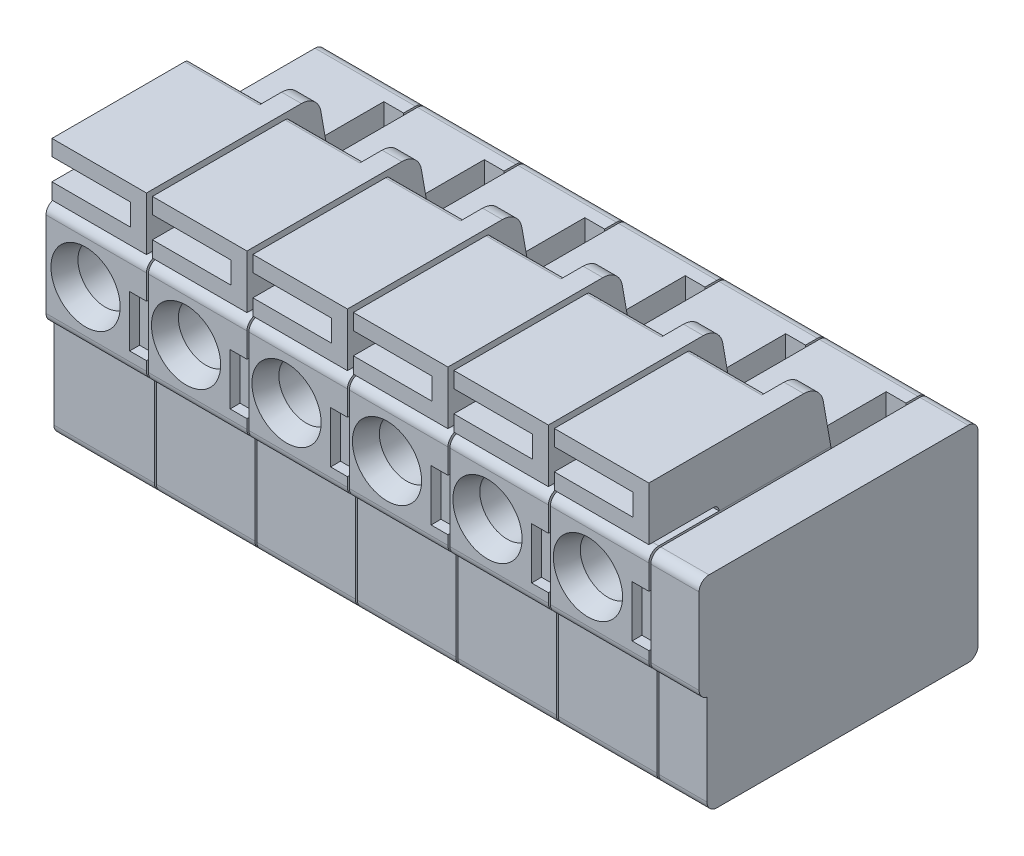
SolidWorks part; units mm, degrees
ref_plane "Спереди" through (0, 0, 0) normal (0, 0, 1) x (1, 0, 0)
ref_plane "Сверху" through (0, 0, 0) normal (0, 1, 0) x (1, 0, 0)
ref_plane "Справа" through (0, 0, 0) normal (1, 0, 0) x (0, 0, -1)
sketch "Эскиз1" plane through (0, 0, 0) normal (1, 0, 0) x (0, 0, -1)
  line L0 (54.1667, 191) -> (270.8333, 191) construction
  line L1 (0, 0) -> (14.1, 0)
  line L2 (0, 0) -> (0, 13.4)
  line L3 (0, 13.4) -> (14.1, 13.4)
  line L4 (14.1, 0) -> (14.1, 13.4)
  line L5 (0, 10.4) -> (14.1, 10.4)
  line L7 (0.4, 5.1) -> (0, 5.1)
  line L8 (0.4, 5.1) -> (0.4, 0)
  line L9 (0.4, 0) -> (0, 0)
  line L10 (0, 5.1) -> (0, 0)
  dimension "D1" = 14.1
  dimension "D2" = 13.4
  dimension "D3" = 10.4
  dimension "D4" = 0.4
  dimension "D5" = 5.1
extrude "Бобышка-Вытянуть1" add sketch "Эскиз1" along normal blind 33.02 contours L7 L8 L1 L4 L5 L2
fillet "Скругление1" radius 0.5 5 edges at (16.51, 10.4, -14.1) (16.51, 0, -14.1) (16.51, 0, -0.4) (16.51, 5.1, 0) (16.51, 10.4, 0)
sketch "Эскиз2" plane through (0, 0, 0) normal (1, 0, 0) x (0, 0, -1)
  line L0 (0, 0) -> (14.1, 0) construction
  line L1 (4.23, 0) -> (5.23, 0)
  line L2 (4.23, 0) -> (4.23, -3.5)
  line L3 (4.23, -3.5) -> (5.23, -3.5)
  line L4 (5.23, 0) -> (5.23, -3.5)
  line L5 (14.1, 0) -> (14.1, 13.4) construction
  line L6 (11.85, 0) -> (12.85, 0)
  line L7 (11.85, 0) -> (11.85, -3.5)
  line L8 (11.85, -3.5) -> (12.85, -3.5)
  line L9 (12.85, 0) -> (12.85, -3.5)
  line L10 (4.23, -2.5) -> (4.4979, -3.5)
  line L11 (4.23, -2.5) -> (12.85, -2.5) construction
  line L12 (5.23, -2.5) -> (4.9621, -3.5)
  line L14 (11.85, -2.5) -> (12.1179, -3.5)
  line L16 (12.85, -2.5) -> (12.5821, -3.5)
  point P10 (4.73, -3.5)
  point P11 (12.35, -3.5)
  dimension "D1" = 1
  dimension "D2" = 1
  dimension "D3" = 3.5
  dimension "D4" = 3.5
  dimension "D5" = 1.75
  dimension "D6" = 7.62
  dimension "D7" = 1
  dimension "D8" = 15
  dimension "D9" = 15
extrude "Бобышка-Вытянуть2" add sketch "Эскиз2" along normal up to surface (33.02 mm away) separate body contours L7 L11 L9 L6 | L11 L14 L8 L16 | L2 L11 L4 L1 | L11 L10 L3 L12
sketch "Эскиз3" plane through (0, 0, 0) normal (1, 0, 0) x (0, 0, -1)
  line L0 (3.55, 10.4) -> (3.55, 10.41)
  line L1 (0, 10.4) -> (14.1, 10.4) construction
  line L2 (3.26, 10.7) -> (0, 10.7)
  line L3 (0, 0) -> (0, 13.4) construction
  line L4 (0, 10.7) -> (0, 13.4)
  line L5 (0, 13.4) -> (7.8319, 13.4)
  line L6 (0, 13.4) -> (14.1, 13.4) construction
  line L7 (8.8167, 12.5736) -> (9.2, 10.4)
  line L8 (3.55, 10.4) -> (9.2, 10.4)
  arc A0 (3.55, 10.41) -> (3.26, 10.7) centre (3.26, 10.41) ccw
  arc A1 (7.8319, 13.4) -> (8.8167, 12.5736) centre (7.8319, 12.4) cw
  point P18 (8.671, 13.4)
  dimension "D5" = 0.29
  dimension "D6" = 1
  dimension "D1" = 9.2
  dimension "D2" = 80
  dimension "D3" = 0.3
  dimension "D4" = 3.55
extrude "Бобышка-Вытянуть3" add sketch "Эскиз3" along normal up to surface (33.02 mm away) separate body
sketch "Эскиз4" plane through (0, 0, 0) normal (0, 0, 1) x (1, 0, 0)
  line L0 (106.6667, 191.5) -> (533.3333, 191.5) construction
  line L1 (33.02, -3.5) -> (0, -3.5) construction
  line L2 (0, 0) -> (2.29, 0)
  line L3 (0, 0) -> (0, -3.5)
  line L4 (0, -3.5) -> (2.29, -3.5)
  line L5 (2.29, 0) -> (2.29, -3.5)
  line L6 (33.02, 0) -> (0, 0) construction
  line L7 (2.79, 0) -> (7.37, 0)
  line L8 (2.79, 0) -> (2.79, -3.5)
  line L9 (2.79, -3.5) -> (7.37, -3.5)
  line L10 (7.37, 0) -> (7.37, -3.5)
  line L11 (7.87, 0) -> (12.45, 0)
  line L12 (7.87, 0) -> (7.87, -3.5)
  line L13 (7.87, -3.5) -> (12.45, -3.5)
  line L14 (12.45, 0) -> (12.45, -3.5)
  line L15 (33.02, -2.5) -> (33.02, -3.5) construction
  line L16 (12.95, 0) -> (17.53, 0)
  line L17 (12.95, 0) -> (12.95, -3.5)
  line L18 (12.95, -3.5) -> (17.53, -3.5)
  line L19 (17.53, 0) -> (17.53, -3.5)
  line L20 (18.03, 0) -> (22.61, 0)
  line L21 (18.03, 0) -> (18.03, -3.5)
  line L22 (18.03, -3.5) -> (22.61, -3.5)
  line L23 (22.61, 0) -> (22.61, -3.5)
  line L24 (23.11, 0) -> (27.69, 0)
  line L25 (23.11, 0) -> (23.11, -3.5)
  line L26 (23.11, -3.5) -> (27.69, -3.5)
  line L27 (27.69, 0) -> (27.69, -3.5)
  line L28 (28.19, 0) -> (33.02, 0)
  line L29 (28.19, 0) -> (28.19, -3.5)
  line L30 (28.19, -3.5) -> (33.02, -3.5)
  line L31 (33.02, 0) -> (33.02, -3.5)
  line L32 (33.02, 13.4) -> (0, 13.4) construction
  line L33 (0, 10.4) -> (0.3, 10.4)
  line L34 (0, 10.4) -> (0, 13.4)
  line L35 (0, 13.4) -> (0.3, 13.4)
  line L36 (0.3, 10.4) -> (0.3, 13.4)
  line L38 (5.08, 10.4) -> (5.38, 10.4)
  line L39 (5.08, 10.4) -> (5.08, 13.4)
  line L40 (5.08, 13.4) -> (5.38, 13.4)
  line L41 (5.38, 10.4) -> (5.38, 13.4)
  line L42 (33.02, 10.4) -> (0, 10.4) construction
  line L43 (10.16, 10.4) -> (10.46, 10.4)
  line L44 (10.16, 10.4) -> (10.16, 13.4)
  line L45 (10.16, 13.4) -> (10.46, 13.4)
  line L46 (10.46, 10.4) -> (10.46, 13.4)
  line L47 (15.24, 10.4) -> (15.54, 10.4)
  line L48 (15.24, 10.4) -> (15.24, 13.4)
  line L49 (15.24, 13.4) -> (15.54, 13.4)
  line L50 (15.54, 10.4) -> (15.54, 13.4)
  line L51 (20.32, 10.4) -> (20.62, 10.4)
  line L52 (20.32, 10.4) -> (20.32, 13.4)
  line L53 (20.32, 13.4) -> (20.62, 13.4)
  line L54 (20.62, 10.4) -> (20.62, 13.4)
  line L55 (25.4, 10.4) -> (25.7, 10.4)
  line L56 (25.4, 10.4) -> (25.4, 13.4)
  line L57 (25.4, 13.4) -> (25.7, 13.4)
  line L58 (25.7, 10.4) -> (25.7, 13.4)
  line L59 (30.48, 10.4) -> (33.02, 10.4)
  line L60 (30.48, 10.4) -> (30.48, 13.4)
  line L61 (30.48, 13.4) -> (33.02, 13.4)
  line L62 (33.02, 10.4) -> (33.02, 13.4)
  dimension "D1" = 0.5
  dimension "D2" = 0.5
  dimension "D3" = 0.5
  dimension "D4" = 0.5
  dimension "D5" = 0.5
  dimension "D6" = 0.5
  dimension "D7" = 2.29
  dimension "D8" = 5.08
  dimension "D9" = 0.3
  dimension "D10" = 5.08
  dimension "D11" = 5.08
  dimension "D12" = 5.08
  dimension "D13" = 5.08
  dimension "D14" = 5.08
  dimension "D15" = 5.08
extrude "Вырез-Вытянуть1" cut sketch "Эскиз4" against normal through all
sketch "Эскиз5" plane through (0, 0, 0) normal (0, 0, 1) x (1, 0, 0)
  line L0 (0, 7.7449) -> (33.02, 7.7449) construction
  line L1 (0, 0) -> (0, 13.4) construction
  line L2 (33.02, 5.5899) -> (33.02, 9.9) construction
  line L3 (5.08, 10.41) -> (0.3, 10.41) construction
  line L4 (4.23, 8.66) -> (5.08, 8.66)
  line L5 (4.23, 8.66) -> (4.23, 6.06)
  line L6 (4.23, 6.06) -> (5.08, 6.06)
  line L7 (5.08, 8.66) -> (5.08, 6.06)
  line L8 (9.31, 8.66) -> (10.16, 8.66)
  line L9 (9.31, 8.66) -> (9.31, 6.06)
  line L10 (9.31, 6.06) -> (10.16, 6.06)
  line L11 (10.16, 8.66) -> (10.16, 6.06)
  line L12 (14.39, 8.66) -> (15.24, 8.66)
  line L13 (14.39, 8.66) -> (14.39, 6.06)
  line L14 (14.39, 6.06) -> (15.24, 6.06)
  line L15 (15.24, 8.66) -> (15.24, 6.06)
  line L16 (19.47, 8.66) -> (20.32, 8.66)
  line L17 (19.47, 8.66) -> (19.47, 6.06)
  line L18 (19.47, 6.06) -> (20.32, 6.06)
  line L19 (20.32, 8.66) -> (20.32, 6.06)
  line L20 (24.55, 8.66) -> (25.4, 8.66)
  line L21 (24.55, 8.66) -> (24.55, 6.06)
  line L22 (24.55, 6.06) -> (25.4, 6.06)
  line L23 (25.4, 8.66) -> (25.4, 6.06)
  line L24 (29.63, 8.66) -> (30.48, 8.66)
  line L25 (29.63, 8.66) -> (29.63, 6.06)
  line L26 (29.63, 6.06) -> (30.48, 6.06)
  line L27 (30.48, 8.66) -> (30.48, 6.06)
  dimension "D1" = 5.08
  dimension "D2" = 0.85
  dimension "D3" = 1.75
  dimension "D4" = 2.6
  dimension "D5" = 5.08
  dimension "D6" = 5.08
  dimension "D7" = 5.08
  dimension "D8" = 5.08
  dimension "D9" = 5.08
extrude "Вырез-Вытянуть2" cut sketch "Эскиз5" against normal blind 0.5
sketch "Эскиз6" plane through (0, 0, 0) normal (0, 0, 1) x (1, 0, 0)
  line L0 (0.3, 10.4) -> (0.3, 13.4) construction
  line L1 (0.3, 12.6) -> (4.28, 12.6)
  line L2 (0.3, 12.6) -> (0.3, 11.5)
  line L3 (0.3, 11.5) -> (4.28, 11.5)
  line L4 (4.28, 12.6) -> (4.28, 11.5)
  line L5 (10.46, 10.4) -> (10.46, 13.4) construction
  line L6 (5.38, 12.6) -> (9.36, 12.6)
  line L7 (5.38, 12.6) -> (5.38, 11.5)
  line L8 (5.38, 11.5) -> (9.36, 11.5)
  line L9 (9.36, 12.6) -> (9.36, 11.5)
  line L10 (10.46, 12.6) -> (14.44, 12.6)
  line L11 (10.46, 12.6) -> (10.46, 11.5)
  line L12 (10.46, 11.5) -> (14.44, 11.5)
  line L13 (14.44, 12.6) -> (14.44, 11.5)
  line L14 (15.54, 10.4) -> (15.54, 13.4) construction
  line L15 (15.54, 12.6) -> (19.52, 12.6)
  line L16 (15.54, 12.6) -> (15.54, 11.5)
  line L17 (15.54, 11.5) -> (19.52, 11.5)
  line L18 (19.52, 12.6) -> (19.52, 11.5)
  line L19 (20.62, 10.4) -> (20.62, 13.4) construction
  line L20 (20.62, 12.6) -> (24.6, 12.6)
  line L21 (20.62, 12.6) -> (20.62, 11.5)
  line L22 (20.62, 11.5) -> (24.6, 11.5)
  line L23 (24.6, 12.6) -> (24.6, 11.5)
  line L24 (25.7, 10.4) -> (25.7, 13.4) construction
  line L25 (25.7, 12.6) -> (29.68, 12.6)
  line L26 (25.7, 12.6) -> (25.7, 11.5)
  line L27 (25.7, 11.5) -> (29.68, 11.5)
  line L28 (29.68, 12.6) -> (29.68, 11.5)
  line L29 (5.08, 13.4) -> (0.3, 13.4) construction
  line L30 (5.08, 10.7) -> (0.3, 10.7) construction
  line L31 (5.08, 10.4) -> (5.08, 13.4) construction
  line L32 (5.38, 10.4) -> (5.38, 13.4) construction
  dimension "D1" = 0.8
  dimension "D2" = 0.8
  dimension "D3" = 0.8
extrude "Вырез-Вытянуть3" cut sketch "Эскиз6" against normal blind 1.5
sketch "Эскиз7" plane through (0, 0, 0) normal (0, 0, 1) x (1, 0, 0)
  line L0 (33.02, 7.7449) -> (0, 7.7449) construction
  line L1 (33.02, 5.5899) -> (33.02, 9.9) construction
  line L2 (0, 0) -> (0, 13.4) construction
  circle A0 centre (2, 7.7449) radius 1.75
  circle A1 centre (7.08, 7.7449) radius 1.75
  circle A2 centre (12.16, 7.7449) radius 1.75
  circle A3 centre (17.24, 7.7449) radius 1.75
  circle A4 centre (22.32, 7.7449) radius 1.75
  circle A5 centre (27.4, 7.7449) radius 1.75
  dimension "D1" = 3.5
  dimension "D2" = 5.08
  dimension "D3" = 5.08
  dimension "D4" = 5.08
  dimension "D5" = 5.08
  dimension "D6" = 5.08
  dimension "D7" = 2
extrude "Вырез-Вытянуть4" cut sketch "Эскиз7" against normal blind 1 draft 20
sketch "Эскиз8" plane through (0, 0, -1) normal (0, 0, 1) x (1, 0, 0)
  circle A2 centre (27.4, 7.7449) radius 1.386
  circle A3 centre (27.4, 7.7449) radius 1.386
  circle A5 centre (22.32, 7.7449) radius 1.386
  circle A6 centre (22.32, 7.7449) radius 1.386
  circle A8 centre (17.24, 7.7449) radius 1.386
  circle A9 centre (17.24, 7.7449) radius 1.386
  circle A11 centre (12.16, 7.7449) radius 1.386
  circle A12 centre (12.16, 7.7449) radius 1.386
  circle A14 centre (7.08, 7.7449) radius 1.386
  circle A15 centre (7.08, 7.7449) radius 1.386
  circle A17 centre (2, 7.7449) radius 1.386
  circle A18 centre (2, 7.7449) radius 1.386
  dimension "D1" = 0
  dimension "D2" = 0
  dimension "D3" = 0
  dimension "D4" = 0
  dimension "D5" = 0
  dimension "D6" = 0
extrude "Вырез-Вытянуть5" cut sketch "Эскиз8" against normal blind 8
sketch "Эскиз9" plane through (0.3, 0, 0) normal (-1, 0, 0) x (0, 0, 1)
  line L0 (38.7333, 189.5) -> (250.0667, 189.5) construction
  line L1 (-1.4, 10.4) -> (-6.8115, 12.9234)
  line L2 (-0.5, 10.4) -> (-13.6, 10.4) construction
  line L3 (-7.8319, 13.4) -> (0, 13.4) construction
  line L4 (-6.7058, 13.4) -> (0, 13.4)
  line L5 (0, 13.4) -> (0, 14.4)
  line L6 (0, 14.4) -> (-13.6, 14.4)
  line L7 (-13.6, 14.4) -> (-13.6, 10.4)
  arc A0 (-6.8115, 12.9234) -> (-6.7058, 13.4) centre (-6.7058, 13.15) cw
  point P20 (-7.8335, 13.4)
  dimension "D4" = 0.25
  dimension "D1" = 4
  dimension "D2" = 25
  dimension "D3" = 1.4
extrude "Вырез-Вытянуть6" cut sketch "Эскиз9" against normal blind 3.78 and the other way through all
sketch "Эскиз10" plane through (5.38, 0, 0) normal (-1, 0, 0) x (0, 0, 1)
  line L12 (-8.8167, 12.5736) -> (-9.2, 10.4)
  line L13 (-9.2, 10.4) -> (-3.55, 10.4)
  line L14 (-3.55, 10.4) -> (-3.55, 10.41)
  line L15 (-3.26, 10.7) -> (-2.0434, 10.7)
  line L16 (-2.0434, 10.7) -> (-6.8115, 12.9234)
  line L17 (-6.7058, 13.4) -> (-7.8319, 13.4)
  line L18 (-8.8167, 12.5736) -> (-9.2, 10.4)
  line L19 (-9.2, 10.4) -> (-3.55, 10.4)
  line L20 (-3.55, 10.4) -> (-3.55, 10.41)
  line L21 (-3.26, 10.7) -> (-2.0434, 10.7)
  line L22 (-2.0434, 10.7) -> (-6.8115, 12.9234)
  line L23 (-6.7058, 13.4) -> (-7.8319, 13.4)
  arc A6 (-3.26, 10.7) -> (-3.55, 10.41) centre (-3.26, 10.41) ccw
  arc A7 (-6.7058, 13.4) -> (-6.8115, 12.9234) centre (-6.7058, 13.15) ccw
  arc A8 (-7.8319, 13.4) -> (-8.8167, 12.5736) centre (-7.8319, 12.4) ccw
  arc A9 (-3.26, 10.7) -> (-3.55, 10.41) centre (-3.26, 10.41) ccw
  arc A10 (-6.7058, 13.4) -> (-6.8115, 12.9234) centre (-6.7058, 13.15) ccw
  arc A11 (-7.8319, 13.4) -> (-8.8167, 12.5736) centre (-7.8319, 12.4) ccw
  dimension "D1" = 0
extrude "Вырез-Вытянуть7" cut sketch "Эскиз10" against normal blind 3.78
sketch "Эскиз13" plane through (10.46, 0, 0) normal (-1, 0, 0) x (0, 0, 1)
  line L12 (-8.8167, 12.5736) -> (-9.2, 10.4)
  line L13 (-9.2, 10.4) -> (-3.55, 10.4)
  line L14 (-3.55, 10.4) -> (-3.55, 10.41)
  line L15 (-3.26, 10.7) -> (-2.0434, 10.7)
  line L16 (-2.0434, 10.7) -> (-6.8115, 12.9234)
  line L17 (-6.7058, 13.4) -> (-7.8319, 13.4)
  line L18 (-8.8167, 12.5736) -> (-9.2, 10.4)
  line L19 (-9.2, 10.4) -> (-3.55, 10.4)
  line L20 (-3.55, 10.4) -> (-3.55, 10.41)
  line L21 (-3.26, 10.7) -> (-2.0434, 10.7)
  line L22 (-2.0434, 10.7) -> (-6.8115, 12.9234)
  line L23 (-6.7058, 13.4) -> (-7.8319, 13.4)
  arc A6 (-7.8319, 13.4) -> (-8.8167, 12.5736) centre (-7.8319, 12.4) ccw
  arc A7 (-3.26, 10.7) -> (-3.55, 10.41) centre (-3.26, 10.41) ccw
  arc A8 (-6.7058, 13.4) -> (-6.8115, 12.9234) centre (-6.7058, 13.15) ccw
  arc A9 (-7.8319, 13.4) -> (-8.8167, 12.5736) centre (-7.8319, 12.4) ccw
  arc A10 (-3.26, 10.7) -> (-3.55, 10.41) centre (-3.26, 10.41) ccw
  arc A11 (-6.7058, 13.4) -> (-6.8115, 12.9234) centre (-6.7058, 13.15) ccw
  dimension "D1" = 0
extrude "Вырез-Вытянуть8" cut sketch "Эскиз13" against normal blind 3.78
sketch "Эскиз14" plane through (15.54, 0, 0) normal (-1, 0, 0) x (0, 0, 1)
  line L12 (-8.8167, 12.5736) -> (-9.2, 10.4)
  line L13 (-9.2, 10.4) -> (-3.55, 10.4)
  line L14 (-3.55, 10.4) -> (-3.55, 10.41)
  line L15 (-3.26, 10.7) -> (-2.0434, 10.7)
  line L16 (-2.0434, 10.7) -> (-6.8115, 12.9234)
  line L17 (-6.7058, 13.4) -> (-7.8319, 13.4)
  line L18 (-8.8167, 12.5736) -> (-9.2, 10.4)
  line L19 (-9.2, 10.4) -> (-3.55, 10.4)
  line L20 (-3.55, 10.4) -> (-3.55, 10.41)
  line L21 (-3.26, 10.7) -> (-2.0434, 10.7)
  line L22 (-2.0434, 10.7) -> (-6.8115, 12.9234)
  line L23 (-6.7058, 13.4) -> (-7.8319, 13.4)
  arc A6 (-7.8319, 13.4) -> (-8.8167, 12.5736) centre (-7.8319, 12.4) ccw
  arc A7 (-3.26, 10.7) -> (-3.55, 10.41) centre (-3.26, 10.41) ccw
  arc A8 (-6.7058, 13.4) -> (-6.8115, 12.9234) centre (-6.7058, 13.15) ccw
  arc A9 (-7.8319, 13.4) -> (-8.8167, 12.5736) centre (-7.8319, 12.4) ccw
  arc A10 (-3.26, 10.7) -> (-3.55, 10.41) centre (-3.26, 10.41) ccw
  arc A11 (-6.7058, 13.4) -> (-6.8115, 12.9234) centre (-6.7058, 13.15) ccw
  dimension "D1" = 0
extrude "Вырез-Вытянуть9" cut sketch "Эскиз14" against normal blind 3.78
sketch "Эскиз15" plane through (20.62, 0, 0) normal (-1, 0, 0) x (0, 0, 1)
  line L12 (-8.8167, 12.5736) -> (-9.2, 10.4)
  line L13 (-9.2, 10.4) -> (-3.55, 10.4)
  line L14 (-3.55, 10.4) -> (-3.55, 10.41)
  line L15 (-3.26, 10.7) -> (-2.0434, 10.7)
  line L16 (-2.0434, 10.7) -> (-6.8115, 12.9234)
  line L17 (-6.7058, 13.4) -> (-7.8319, 13.4)
  line L18 (-8.8167, 12.5736) -> (-9.2, 10.4)
  line L19 (-9.2, 10.4) -> (-3.55, 10.4)
  line L20 (-3.55, 10.4) -> (-3.55, 10.41)
  line L21 (-3.26, 10.7) -> (-2.0434, 10.7)
  line L22 (-2.0434, 10.7) -> (-6.8115, 12.9234)
  line L23 (-6.7058, 13.4) -> (-7.8319, 13.4)
  arc A6 (-7.8319, 13.4) -> (-8.8167, 12.5736) centre (-7.8319, 12.4) ccw
  arc A7 (-3.26, 10.7) -> (-3.55, 10.41) centre (-3.26, 10.41) ccw
  arc A8 (-6.7058, 13.4) -> (-6.8115, 12.9234) centre (-6.7058, 13.15) ccw
  arc A9 (-7.8319, 13.4) -> (-8.8167, 12.5736) centre (-7.8319, 12.4) ccw
  arc A10 (-3.26, 10.7) -> (-3.55, 10.41) centre (-3.26, 10.41) ccw
  arc A11 (-6.7058, 13.4) -> (-6.8115, 12.9234) centre (-6.7058, 13.15) ccw
  dimension "D1" = 0
extrude "Вырез-Вытянуть10" cut sketch "Эскиз15" against normal blind 3.78
sketch "Эскиз16" plane through (25.7, 0, 0) normal (-1, 0, 0) x (0, 0, 1)
  line L12 (-8.8167, 12.5736) -> (-9.2, 10.4)
  line L13 (-9.2, 10.4) -> (-3.55, 10.4)
  line L14 (-3.55, 10.4) -> (-3.55, 10.41)
  line L15 (-3.26, 10.7) -> (-2.0434, 10.7)
  line L16 (-2.0434, 10.7) -> (-6.8115, 12.9234)
  line L17 (-6.7058, 13.4) -> (-7.8319, 13.4)
  line L18 (-8.8167, 12.5736) -> (-9.2, 10.4)
  line L19 (-9.2, 10.4) -> (-3.55, 10.4)
  line L20 (-3.55, 10.4) -> (-3.55, 10.41)
  line L21 (-3.26, 10.7) -> (-2.0434, 10.7)
  line L22 (-2.0434, 10.7) -> (-6.8115, 12.9234)
  line L23 (-6.7058, 13.4) -> (-7.8319, 13.4)
  arc A6 (-7.8319, 13.4) -> (-8.8167, 12.5736) centre (-7.8319, 12.4) ccw
  arc A7 (-3.26, 10.7) -> (-3.55, 10.41) centre (-3.26, 10.41) ccw
  arc A8 (-6.7058, 13.4) -> (-6.8115, 12.9234) centre (-6.7058, 13.15) ccw
  arc A9 (-7.8319, 13.4) -> (-8.8167, 12.5736) centre (-7.8319, 12.4) ccw
  arc A10 (-3.26, 10.7) -> (-3.55, 10.41) centre (-3.26, 10.41) ccw
  arc A11 (-6.7058, 13.4) -> (-6.8115, 12.9234) centre (-6.7058, 13.15) ccw
  dimension "D1" = 0
extrude "Вырез-Вытянуть11" cut sketch "Эскиз16" against normal blind 3.78
sketch "Эскиз17" plane through (0, 10.4, 0) normal (0, 1, 0) x (1, 0, 0)
  line L0 (106.8333, 159.5) -> (534.1667, 159.5) construction
  line L1 (5.08, 7.8319) -> (5.08, 0) construction
  line L2 (5.08, 9.2) -> (4.08, 9.2)
  line L3 (5.08, 9.2) -> (5.08, 13)
  line L4 (5.08, 13) -> (4.08, 13)
  line L5 (4.08, 9.2) -> (4.08, 13)
  line L6 (10.16, 7.8319) -> (10.16, 0) construction
  line L7 (10.16, 9.2) -> (9.16, 9.2)
  line L8 (10.16, 9.2) -> (10.16, 13)
  line L9 (10.16, 13) -> (9.16, 13)
  line L10 (9.16, 9.2) -> (9.16, 13)
  line L11 (15.24, 7.8319) -> (15.24, 0) construction
  line L12 (15.24, 9.2) -> (14.24, 9.2)
  line L13 (15.24, 9.2) -> (15.24, 13)
  line L14 (15.24, 13) -> (14.24, 13)
  line L15 (14.24, 9.2) -> (14.24, 13)
  line L16 (20.32, 7.8319) -> (20.32, 0) construction
  line L17 (20.32, 9.2) -> (19.32, 9.2)
  line L18 (20.32, 9.2) -> (20.32, 13)
  line L19 (20.32, 13) -> (19.32, 13)
  line L20 (19.32, 9.2) -> (19.32, 13)
  line L21 (25.4, 7.8319) -> (25.4, 0) construction
  line L22 (25.4, 9.2) -> (24.4, 9.2)
  line L23 (25.4, 9.2) -> (25.4, 13)
  line L24 (25.4, 13) -> (24.4, 13)
  line L25 (24.4, 9.2) -> (24.4, 13)
  line L26 (30.48, 7.8319) -> (30.48, 0) construction
  line L27 (30.48, 9.2) -> (29.48, 9.2)
  line L28 (30.48, 9.2) -> (30.48, 13)
  line L29 (30.48, 13) -> (29.48, 13)
  line L30 (29.48, 9.2) -> (29.48, 13)
  line L31 (0, 14.1) -> (33.02, 14.1) construction
  line L32 (9.16, 9.2) -> (9.16, 3.55) construction
  line L33 (10.16, 9.2) -> (9.16, 9.2) construction
  dimension "D1" = 1.1
extrude "Вырез-Вытянуть12" cut sketch "Эскиз17" against normal blind 3.78
sketch "Эскиз18" plane through (0, 0, 0) normal (0, 0, 1) x (1, 0, 0)
  line L0 (33.02, 0) -> (0, 0) construction
  line L1 (5.08, 13.4) -> (5.18, 13.4)
  line L2 (5.08, 13.4) -> (5.08, 0)
  line L3 (5.08, 0) -> (5.18, 0)
  line L4 (5.18, 13.4) -> (5.18, 0)
  line L5 (10.16, 13.4) -> (10.26, 13.4)
  line L6 (10.16, 13.4) -> (10.16, 0)
  line L7 (10.16, 0) -> (10.26, 0)
  line L8 (10.26, 13.4) -> (10.26, 0)
  line L9 (15.24, 13.4) -> (15.34, 13.4)
  line L10 (15.24, 13.4) -> (15.24, 0)
  line L11 (15.24, 0) -> (15.34, 0)
  line L12 (15.34, 13.4) -> (15.34, 0)
  line L13 (20.32, 13.4) -> (20.42, 13.4)
  line L14 (20.32, 13.4) -> (20.32, 0)
  line L15 (20.32, 0) -> (20.42, 0)
  line L16 (20.42, 13.4) -> (20.42, 0)
  line L17 (25.4, 13.4) -> (25.5, 13.4)
  line L18 (25.4, 13.4) -> (25.4, 0)
  line L19 (25.4, 0) -> (25.5, 0)
  line L20 (25.5, 13.4) -> (25.5, 0)
  line L21 (30.48, 13.4) -> (30.58, 13.4)
  line L22 (30.48, 13.4) -> (30.48, 0)
  line L23 (30.48, 0) -> (30.58, 0)
  line L24 (30.58, 13.4) -> (30.58, 0)
  dimension "D1" = 0.1
extrude "Вырез-Вытянуть13" cut sketch "Эскиз18" against normal through all
